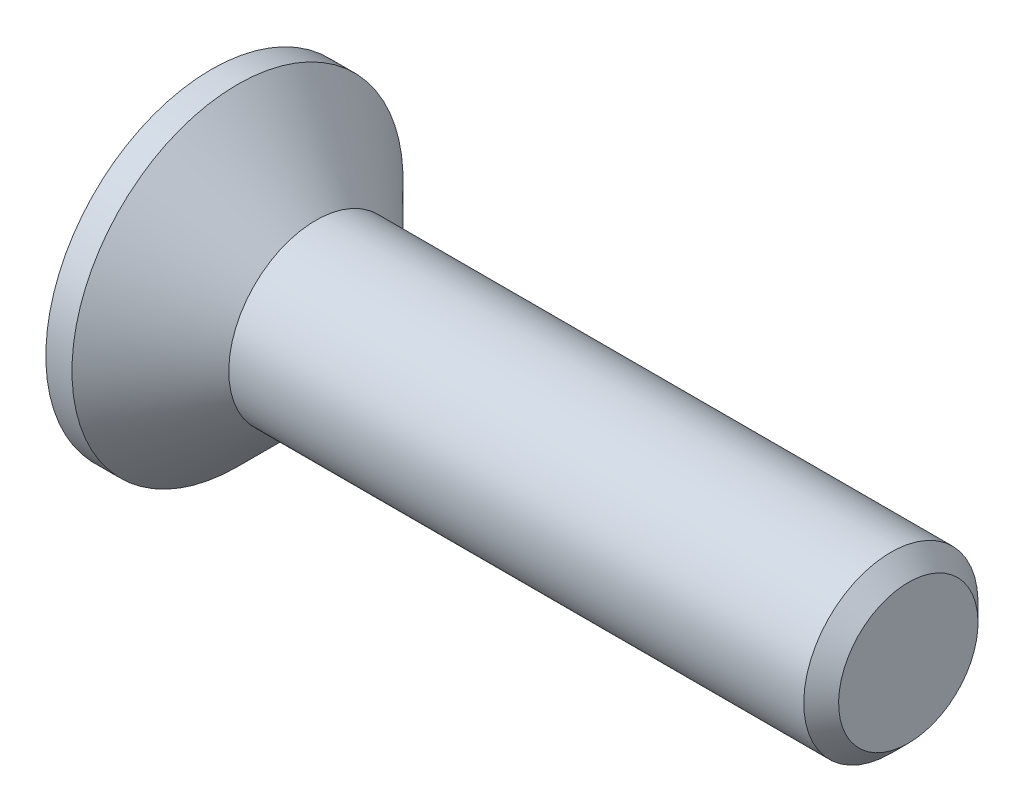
SolidWorks part; units mm, degrees
ref_plane "Front Plane" through (0, 0, 0) normal (0, 0, 1) x (1, 0, 0)
ref_plane "Top Plane" through (0, 0, 0) normal (0, 1, 0) x (1, 0, 0)
ref_plane "Right Plane" through (0, 0, 0) normal (1, 0, 0) x (0, 0, -1)
sketch "Sketch1" plane through (0, 0, 0) normal (0, 0, 1) x (1, 0, 0)
  line L1 (-1.2, 1.9) -> (-1.2, 0)
  line L2 (-1.2, 0) -> (6.8, 0)
  line L3 (6.8, 0) -> (6.8, 1)
  line L4 (6.8, 1) -> (0, 1)
  line L5 (-1.2, 1.9) -> (-0.9, 1.9)
  line L6 (-0.9, 1.9) -> (0, 1)
  dimension "D1" = 1
  dimension "D2" = 45
  dimension "D3" = 1.2
  dimension "D4" = 8
  dimension "D5" = 1.9
revolve "Revolve1" add sketch "Sketch1" angle 360 about L2
chamfer "Chamfer1" distance 0.2 angle 45 1 edges at (6.8, -1, 0)
sketch "Sketch2" plane through (-1.2, 0, 0) normal (-1, 0, 0) x (0, 0, 1)
  line L0 (-0.3, 1.175) -> (0.3, 1.175)
  line L1 (0.3, 1.175) -> (0.3, 0.3)
  line L2 (0.3, 0.3) -> (1.175, 0.3)
  line L3 (1.175, 0.3) -> (1.175, -0.3)
  line L4 (1.175, -0.3) -> (0.3, -0.3)
  line L5 (0.3, -0.3) -> (0.3, -1.175)
  line L6 (0.3, -1.175) -> (-0.3, -1.175)
  line L7 (-0.3, -1.175) -> (-0.3, -0.3)
  line L8 (-0.3, -0.3) -> (-1.175, -0.3)
  line L9 (-1.175, -0.3) -> (-1.175, 0.3)
  line L10 (-1.175, 0.3) -> (-0.3, 0.3)
  line L11 (-0.3, 0.3) -> (-0.3, 1.175)
  point P5 (0, 1.175)
  point P13 (1.175, 0)
  point P15 (-1.175, 0)
  point P16 (0, -1.175)
  point P17 (0.3, 1.085)
  dimension "D1" = 0.6
  dimension "D2" = 2.35
extrude "Cut-Extrude1" cut sketch "Sketch2" against normal blind 0.95
